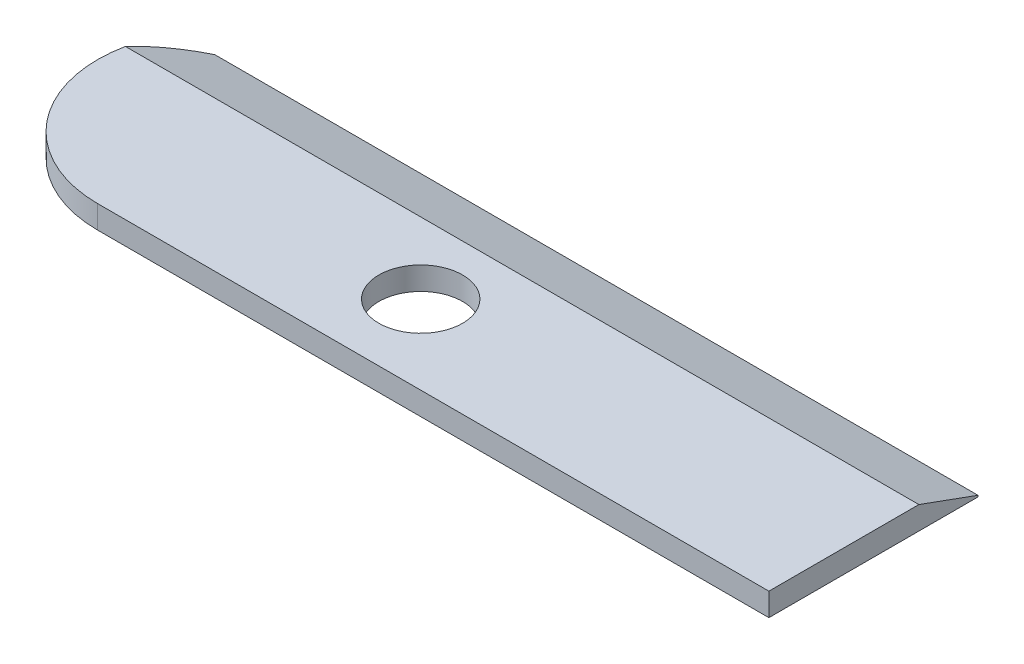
SolidWorks part; units mm, degrees
ref_plane "Front" through (0, 0, 0) normal (0, 0, 1) x (1, 0, 0)
ref_plane "Top" through (0, 0, 0) normal (0, 1, 0) x (1, 0, 0)
ref_plane "Right" through (0, 0, 0) normal (1, 0, 0) x (0, 0, -1)
sketch "Sketch1" plane through (0, 0, 0) normal (0, 1, 0) x (1, 0, 0)
  line L1 (-15.0426, 20.8124) -> (-15.0426, 14.446)
  line L3 (-35.4774, 14.446) -> (-15.0426, 14.446)
  line L4 (-15.0426, 20.8124) -> (-38.2798, 20.8124)
  circle A0 centre (-28.0426, 16.846) radius 1.275
  arc A2 (-38.2798, 20.8124) -> (-35.4774, 14.446) centre (-35.4774, 18.246) ccw
  dimension "D3" = 3.8
  dimension "D6" = 2.55
  dimension "D1" = 13
  dimension "D2" = 6.3664
  dimension "D4" = 2.4
  dimension "D5" = 7.4348
extrude "Blade" add sketch "Sketch1" along normal blind 0.7
chamfer "cutting edge" distance 1.8 angle 20 1 edges at (-26.6612, 0.7, -20.8124)
